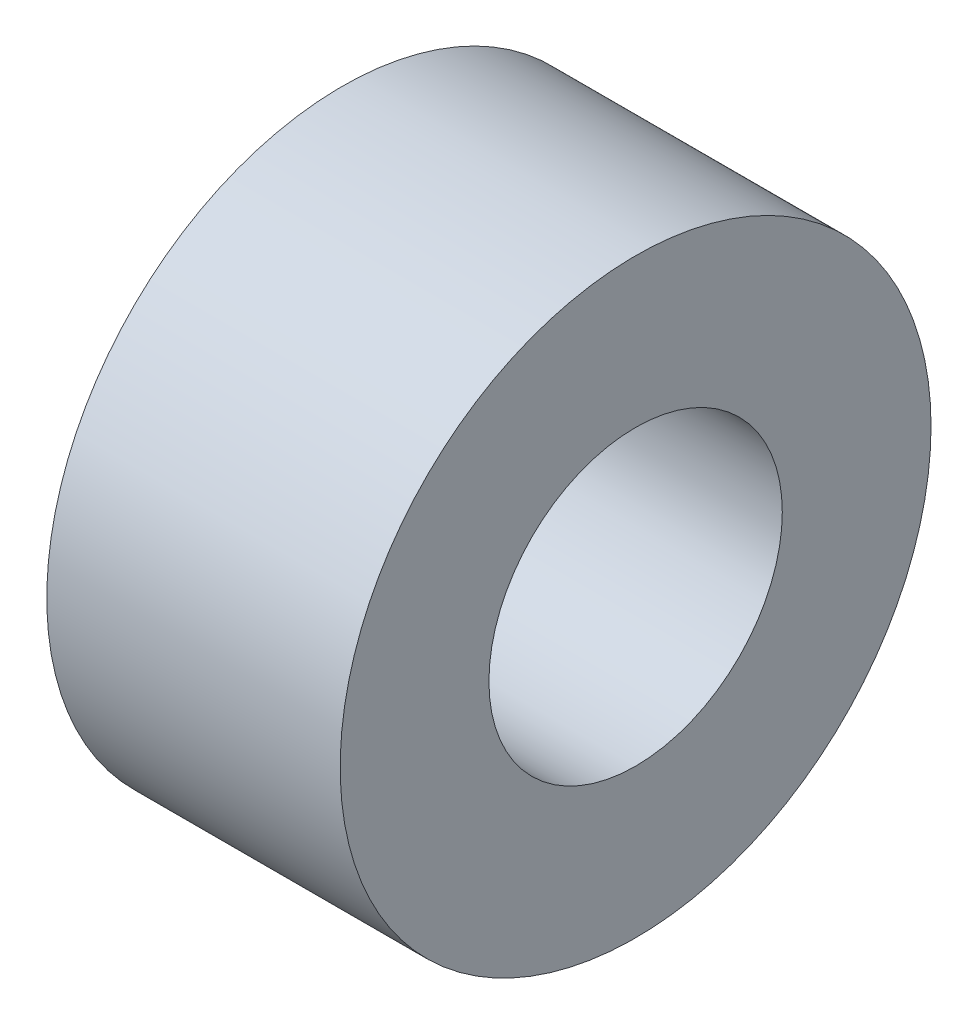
SolidWorks part; units mm, degrees
ref_plane "Front Plane" through (0, 0, 0) normal (0, 0, 1) x (1, 0, 0)
ref_plane "Top Plane" through (0, 0, 0) normal (0, 1, 0) x (1, 0, 0)
ref_plane "Right Plane" through (0, 0, 0) normal (1, 0, 0) x (0, 0, -1)
sketch "Sketch2" plane through (0, 0, 0) normal (0, 0, 1) x (1, 0, 0)
  line L0 (-0.3547, 12.7) -> (-0.3547, 25.5773)
  line L1 (-0.3547, 25.5773) -> (-25.7547, 25.5773)
  line L2 (-25.7547, 25.5773) -> (-25.7547, 12.7)
  line L3 (-25.7547, 12.7) -> (-0.3547, 12.7)
  line L4 (7.2972, 0) -> (-36.0566, 0) construction
  dimension "D1" = 25.4
  dimension "D2" = 12.7
revolve "Revolve1" add sketch "Sketch2" angle 360 about L4
